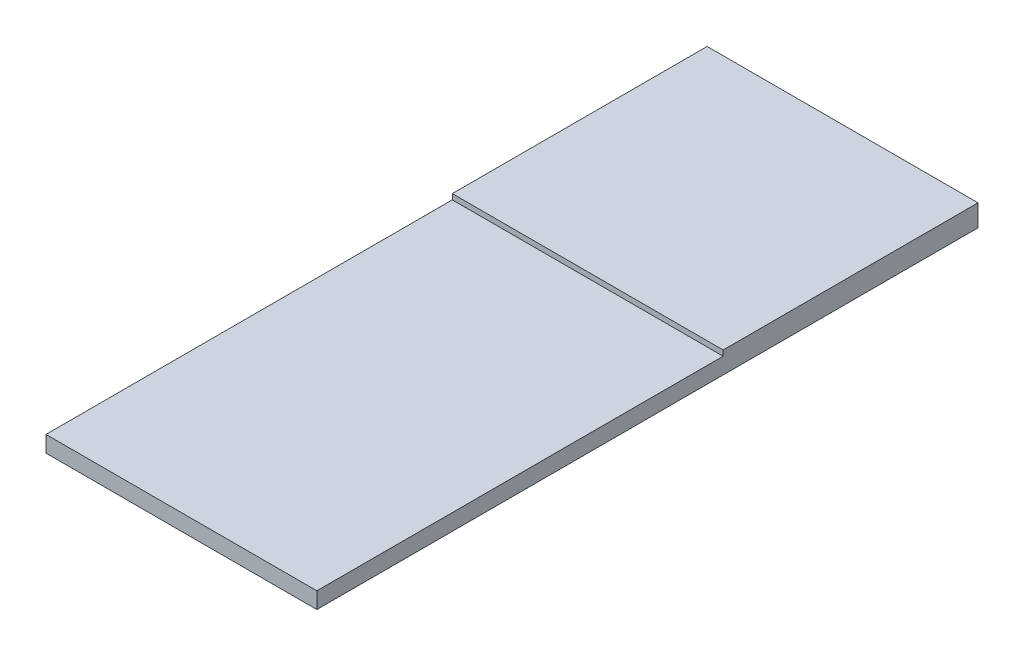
SolidWorks part; units mm, degrees
ref_plane "Front Plane" through (0, 0, 0) normal (0, 0, 1) x (1, 0, 0)
ref_plane "Top Plane" through (0, 0, 0) normal (0, 1, 0) x (1, 0, 0)
ref_plane "Right Plane" through (0, 0, 0) normal (1, 0, 0) x (0, 0, -1)
sketch "Sketch1" plane through (0, 0, 0) normal (0, 1, 0) x (1, 0, 0)
  line L1 (0, 0) -> (12.7, 0)
  line L2 (0, 0) -> (0, 31)
  line L3 (0, 31) -> (12.7, 31)
  line L4 (12.7, 0) -> (12.7, 31)
  dimension "D1" = 12.7
  dimension "D2" = 31
extrude "Boss-Extrude1" add sketch "Sketch1" along normal blind 1.016
sketch "Sketch2" plane through (0, 1.016, 0) normal (0, 1, 0) x (1, 0, 0)
  line L0 (12.7, 0) -> (12.7, 31) construction
  line L1 (0, 0) -> (12.7, 0)
  line L2 (0, 0) -> (0, 19.05)
  line L3 (0, 19.05) -> (12.7, 19.05)
  line L4 (12.7, 0) -> (12.7, 19.05)
  dimension "D1" = 19.05
extrude "Cut-Extrude1" cut sketch "Sketch2" against normal blind 0.254 and the other way through all
